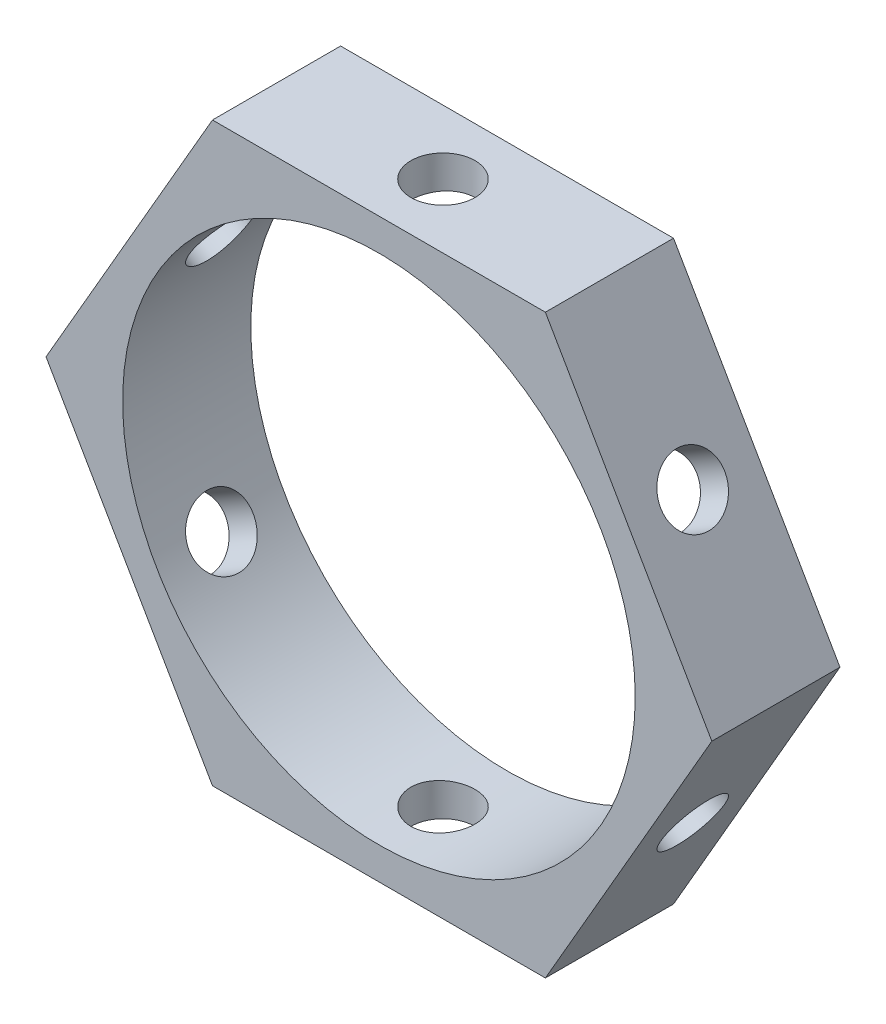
SolidWorks part; units mm, degrees
ref_plane "Front" through (0, 0, 0) normal (0, 0, 1) x (1, 0, 0)
ref_plane "Top" through (0, 0, 0) normal (0, 1, 0) x (1, 0, 0)
ref_plane "Right" through (0, 0, 0) normal (1, 0, 0) x (0, 0, -1)
sketch "Sketch1" plane through (0, 0, 0) normal (0, 0, 1) x (1, 0, 0)
  line L1 (25.9808, 0) -> (12.9904, 22.5)
  line L2 (12.9904, 22.5) -> (-12.9904, 22.5)
  line L3 (-12.9904, 22.5) -> (-25.9808, 0)
  line L4 (-25.9808, 0) -> (-12.9904, -22.5)
  line L5 (-12.9904, -22.5) -> (12.9904, -22.5)
  line L6 (12.9904, -22.5) -> (25.9808, 0)
  circle A0 centre (0, 0) radius 20
  circle A1 centre (0, 0) radius 22.5 construction
  dimension "D1" = 40
  dimension "D2" = 45
extrude "Extrude1" add sketch "Sketch1" along normal blind 10
sketch "Sketch2" plane through (19.4856, 11.25, 0) normal (0.866, 0.5, 0) x (0, 0, -1)
  line L0 (-10, 12.9904) -> (0, -12.9904) construction
  circle A0 centre (-5, 0) radius 2.5
  dimension "D1" = 5
extrude "Cut-Extrude1" cut sketch "Sketch2" against normal through all
sketch "Sketch3" plane through (0, -22.5, 0) normal (0, -1, 0) x (1, 0, 0)
  line L0 (12.9904, 0) -> (-12.9904, 10) construction
  circle A0 centre (0, 5) radius 2.5
  dimension "D1" = 5
extrude "Cut-Extrude2" cut sketch "Sketch3" against normal through all
sketch "Sketch4" plane through (19.4856, -11.25, 0) normal (0.866, -0.5, 0) x (0, 0, -1)
  line L0 (-10, 12.9904) -> (0, -12.9904) construction
  circle A0 centre (-5, 0) radius 2.5
  dimension "D1" = 5
extrude "Cut-Extrude3" cut sketch "Sketch4" against normal through all
